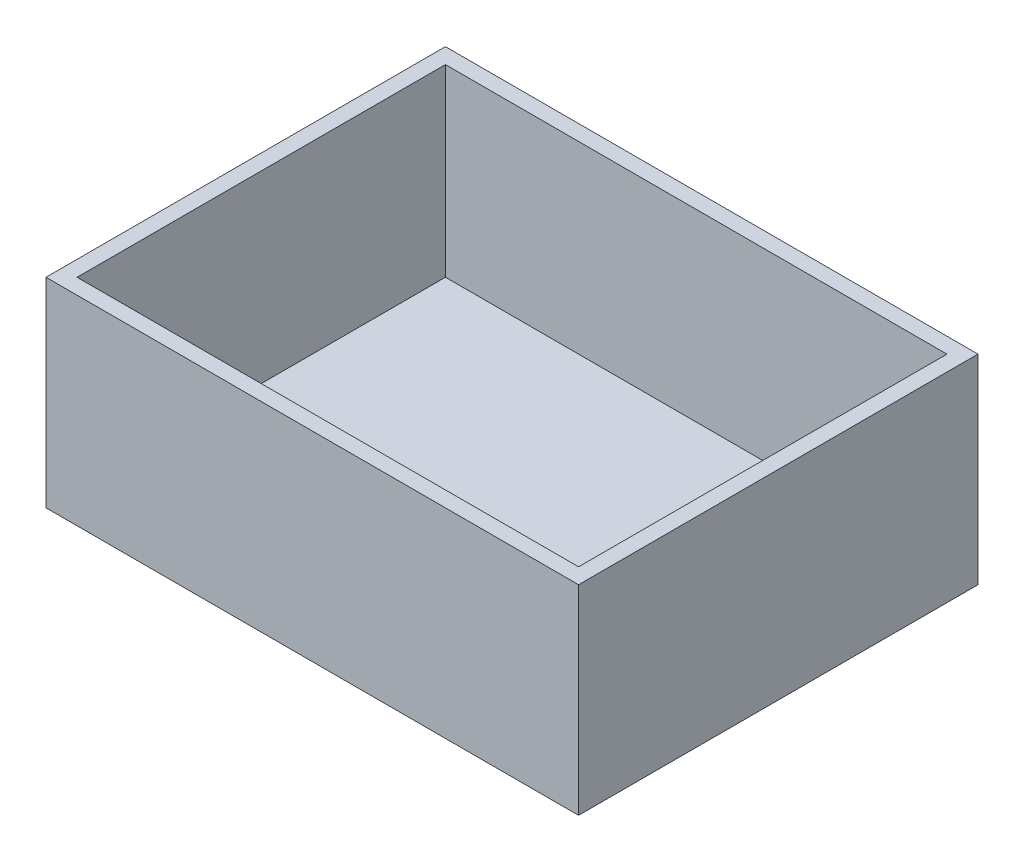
SolidWorks part; units mm, degrees
ref_plane "前视基准面" through (0, 0, 0) normal (0, 0, 1) x (1, 0, 0)
ref_plane "上视基准面" through (0, 0, 0) normal (0, 1, 0) x (1, 0, 0)
ref_plane "右视基准面" through (0, 0, 0) normal (1, 0, 0) x (0, 0, -1)
other "Configuration Table"
sketch "草图1" plane through (0, 0, 0) normal (0, 1, 0) x (1, 0, 0)
  line L1 (-60, -45) -> (60, -45)
  line L2 (-60, -45) -> (-60, 45)
  line L3 (-60, 45) -> (60, 45)
  line L4 (60, -45) -> (60, 45)
  line L5 (-60, -45) -> (60, 45) construction
  line L6 (-60, 45) -> (60, -45) construction
  point P0 (0, 0)
extrude "凸台-拉伸1" add sketch "草图1" along normal blind 45
sketch "草图2" plane through (0, 45, 0) normal (0, 1, 0) x (1, 0, 0)
  line L1 (-56.5, -41.5) -> (56.5, -41.5)
  line L2 (-56.5, -41.5) -> (-56.5, 41.5)
  line L3 (-56.5, 41.5) -> (56.5, 41.5)
  line L4 (56.5, -41.5) -> (56.5, 41.5)
  line L5 (-56.5, -41.5) -> (56.5, 41.5) construction
  line L6 (-56.5, 41.5) -> (56.5, -41.5) construction
  point P0 (0, 0)
extrude "切除-拉伸1" cut sketch "草图2" against normal blind 41.5
